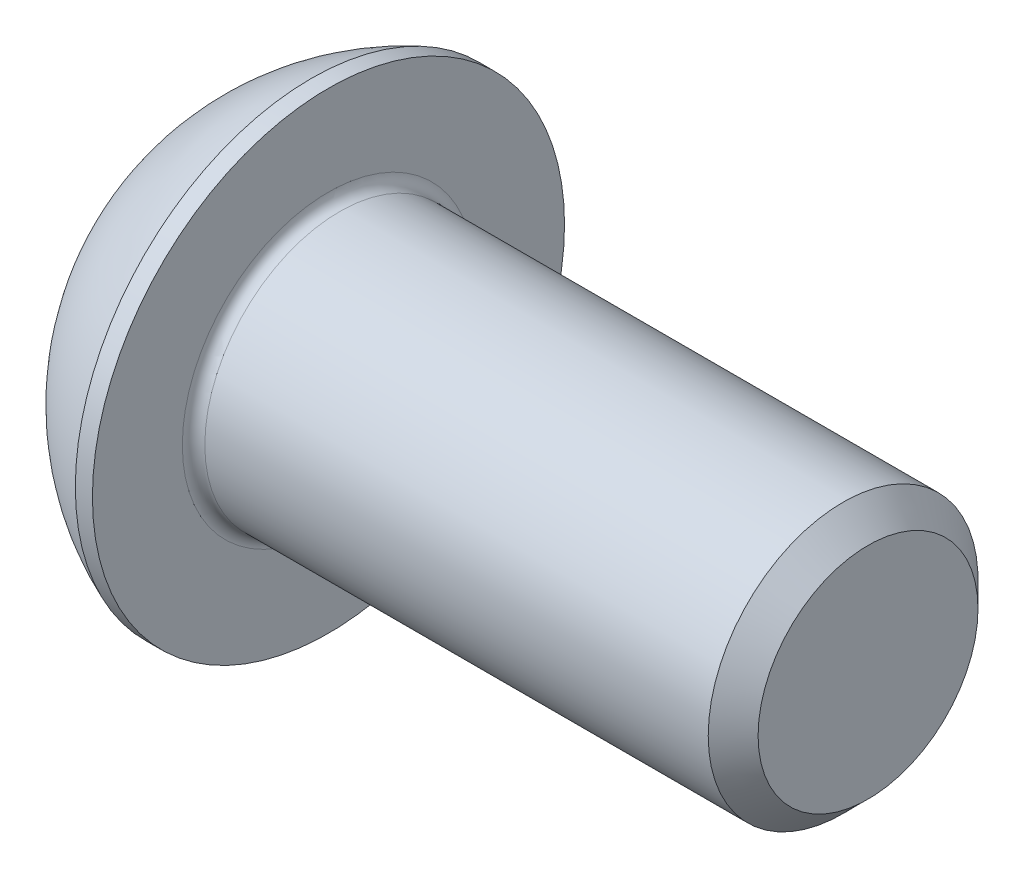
SolidWorks part; units mm, degrees
ref_plane "Plane1" through (0, 0, 0) normal (0, 0, 1) x (1, 0, 0)
ref_plane "Plane2" through (0, 0, 0) normal (0, 1, 0) x (1, 0, 0)
ref_plane "Plane3" through (0, 0, 0) normal (1, 0, 0) x (0, 0, -1)
sketch "BodySke" plane through (0, 0, 0) normal (0, 0, 1) x (1, 0, 0)
  line L0 (15.3, 0) -> (15.3, 2.4455)
  line L1 (14.7455, 3) -> (3.3, 3)
  line L2 (3.3, 3) -> (3.3, 5.25)
  line L3 (3.3, 5.25) -> (2.92, 5.25)
  line L4 (0, 0) -> (101.6, 0) construction
  line L5 (3.3, -5.25) -> (2.92, -5.25) construction
  line L6 (55.6768, -3) -> (3.3, -3) construction
  line L7 (15.3, 0) -> (0, 0)
  line L8 (0, 2.625) -> (0, -2.625) construction
  line L9 (0, 0) -> (0, 2.625)
  line L10 (15.3, 2.4455) -> (14.7455, 3)
  line L11 (15.3, -2.4455) -> (14.7455, -3) construction
  line L12 (4.3, 9.525) -> (4.3, -3) construction
  line L13 (3.3, 9.525) -> (3.3, -3) construction
  arc A1 (0, 2.625) -> (2.92, 5.25) centre (4.9997, 0) cw
revolve "BaseBody" add sketch "BodySke" angle 360 about L4
fillet "Fillet1" radius 0.25 1 edges at (3.3, 0, 3)
sketch "Sketch2" plane through (0, 0, 0) normal (0, 0, 1) x (1, 0, 0)
  line L0 (0, 2) -> (2.08, 2)
  line L1 (2.08, 2) -> (3.2347, 0)
  line L3 (3.2347, 0) -> (0, 0)
  line L4 (0, 0) -> (0, 2)
  line L5 (0, -2) -> (2.08, -2) construction
  line L6 (0, 0) -> (47.625, 0) construction
  dimension "D2" = 60
  dimension "PreBroach_depth" = 2.08
  dimension "PreBroach_dia" = 4
revolve "PreBroach" cut sketch "Sketch2" angle 360 about L6
sketch "Sketch3" plane through (0, 0, 0) normal (1, 0, 0) x (0, 0, -1)
  line L0 (-2, -1.1547) -> (-2, 1.1547)
  line L1 (-2, 1.1547) -> (0, 2.3094)
  line L2 (0, 2.3094) -> (2, 1.1547)
  line L3 (2, 1.1547) -> (2, -1.1547)
  line L4 (2, -1.1547) -> (0, -2.3094)
  line L5 (0, -2.3094) -> (-2, -1.1547)
extrude "Hex" cut sketch "Sketch3" along normal blind 2.08
sketch "ThdSchSke" plane through (0, 0, 0) normal (0, 0, 1) x (1, 0, 0)
  line L0 (5.3, -2.4455) -> (4.9117, -3)
  line L1 (5.3, -2.4455) -> (5.6883, -3)
  line L2 (5.6883, -3) -> (5.6883, -3.75)
  line L3 (-3.175, 0) -> (5.1513, 0) construction
  line L5 (5.6883, -3.75) -> (4.9117, -3.75)
  line L6 (4.9117, -3.75) -> (4.9117, -3)
revolve "ThreadSchematic" [suppressed] cut sketch "ThdSchSke" angle 360 about L3
pattern_linear "ThdSchPat" [suppressed]
equation "\"D1@BodySke\" = \"Head_dia@BodySke\" * .5"
equation "\"Thread_minor@ThreadCosmetic\" = \"Minor_dia@BodySke\""
equation "\"D1@Sketch3\" = \"Hex_size@Sketch3\" / 2"
equation "\"D2@Sketch3\" = \"D1@Sketch3\""
equation "\"D3@Sketch3\" = \"Hex_size@Sketch3\""
equation "\"Thread_length@ThreadCosmetic\" = ((sgn( (\"Length@BodySke\" - \"Advance@BodySke\" * 2.0) - \"Thread_nom@BodySke\" )-1)*( (\"Length@BodySke\" - \"Advance@BodySke\" * 2.0) - \"Thread_nom@BodySke\" ))/-2+ \"Thread_no"
equation "\"Thread_minor@ThdSchSke\" = \"Minor_dia@BodySke\""
equation "\"Diameter@ThdSchSke\" = \"Diameter@BodySke\""
equation "\"Overcut@ThdSchSke\" = \"Diameter@BodySke\" * 1.25"
equation "\"Start@ThdSchSke\" = \"Head_ht@BodySke\" + \"Length@BodySke\" - \"Thread_length@ThreadCosmetic\"  '---Non-countersunk---"
equation "\"Num_threads@ThdSchPat\" = int( \"Thread_length@ThreadCosmetic\" / \"Advance@BodySke\" + 0.999 )  + 1"
equation "\"Advance@ThdSchPat\" = \"Thread_length@ThreadCosmetic\" /  (\"Num_threads@ThdSchPat\" - 1) 'relax it"
equation "\"Num_threads@ThdSchPat\" = \"Num_threads@ThdSchPat\" - sgn( \"Num_threads@ThdSchPat\" - 1) '---chamfered tips only---"
